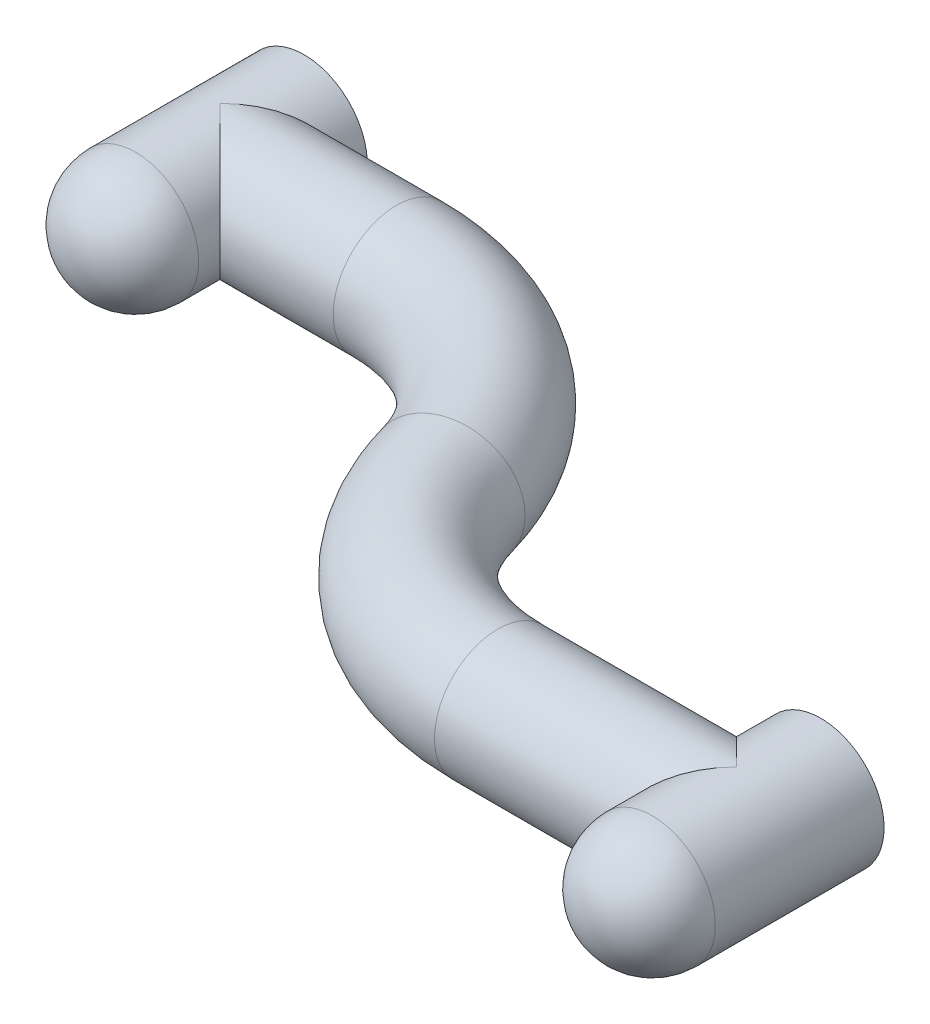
SolidWorks part; units mm, degrees
ref_plane "Plan de face" through (0, 0, 0) normal (0, 0, 1) x (1, 0, 0)
ref_plane "Plan de dessus" through (0, 0, 0) normal (0, 1, 0) x (1, 0, 0)
ref_plane "Plan de droite" through (0, 0, 0) normal (1, 0, 0) x (0, 0, -1)
sketch "Esquisse1" plane through (0, 0, 0) normal (0, 1, 0) x (1, 0, 0)
  line L0 (0, 0) -> (-113.2035, 0)
  line L1 (-311.2236, 150) -> (-395, 150)
  arc A0 (-113.2035, 0) -> (-212.2136, 75) centre (-113.2035, 102.8533) cw
  arc A1 (-212.2136, 75) -> (-311.2236, 150) centre (-311.2236, 47.1467) ccw
  dimension "D1" = 395
  dimension "D2" = 150
sketch "Esquisse2" plane through (0, 0, 0) normal (1, 0, 0) x (0, 0, -1)
  circle A0 centre (0, 0) radius 30
  circle A1 centre (0, 0) radius 27
  dimension "D1" = 3
  dimension "D2" = 60
sweep "Balayage1" add profiles "Esquisse2" path "Esquisse1"
sketch "Esquisse3" plane through (0, 0, 0) normal (0, 1, 0) x (1, 0, 0)
  line L0 (0, -30) -> (0, 30) construction
  line L1 (0, 40) -> (30, 40)
  line L2 (0, 40) -> (0, -40)
  line L3 (0, -40) -> (30, -40)
  line L4 (30, 40) -> (30, -40)
  dimension "D1" = 30
  dimension "D2" = 80
revolve "Révolution1" add sketch "Esquisse3" angle 360 about L2
sketch "Esquisse4" plane through (0, 0, 0) normal (0, 1, 0) x (1, 0, 0)
  line L0 (-395, 180) -> (-395, 120) construction
  line L1 (-395, 190) -> (-425, 190)
  line L2 (-395, 190) -> (-395, 110)
  line L3 (-395, 110) -> (-425, 110)
  line L4 (-425, 190) -> (-425, 110)
  line L6 (-395, 150) -> (-1676.3089, 150) construction
  line L7 (-395, 177) -> (-395, 123) construction
  dimension "D1" = 30
  dimension "D2" = 80
revolve "Révolution2" add sketch "Esquisse4" angle 360 about L2
sketch "Esquisse5" plane through (0, 0, 40) normal (0, 0, 1) x (1, 0, 0)
  circle A2 centre (0, 0) radius 27
  circle A3 centre (0, 0) radius 27
  circle A5 centre (-395, 0) radius 27
  circle A6 centre (-395, 0) radius 27
  dimension "D1" = 3
  dimension "D2" = 3
extrude "Enlèv. mat.-Extru.1" cut sketch "Esquisse5" against normal through all
sketch "Esquisse6" plane through (0, 0, 0) normal (0, 1, 0) x (1, 0, 0)
  line L0 (0, 74.7521) -> (0, -103.2471) construction
  line L1 (0, -40) -> (0, 40) construction
  line L2 (-30, -40) -> (0, -40)
  line L3 (-30, -40) -> (30, -40) construction
  line L4 (0, -40) -> (0, -70)
  arc A0 (0, -70) -> (-30, -40) centre (0, -40) cw
revolve "Révolution3" add sketch "Esquisse6" angle 360 about L4
sketch "Esquisse7" plane through (0, 0, 0) normal (0, 1, 0) x (1, 0, 0)
  line L0 (-395, 190) -> (-395, 69.3276) construction
  line L1 (-368, 190) -> (-422, 190) construction
  line L2 (-395, 110) -> (-395, 190) construction
  line L3 (-425, 110) -> (-395, 110)
  line L4 (-425, 110) -> (-365, 110) construction
  line L5 (-395, 110) -> (-395, 80)
  arc A0 (-395, 80) -> (-425, 110) centre (-395, 110) cw
revolve "Révolution4" add sketch "Esquisse7" angle 360 about L5
